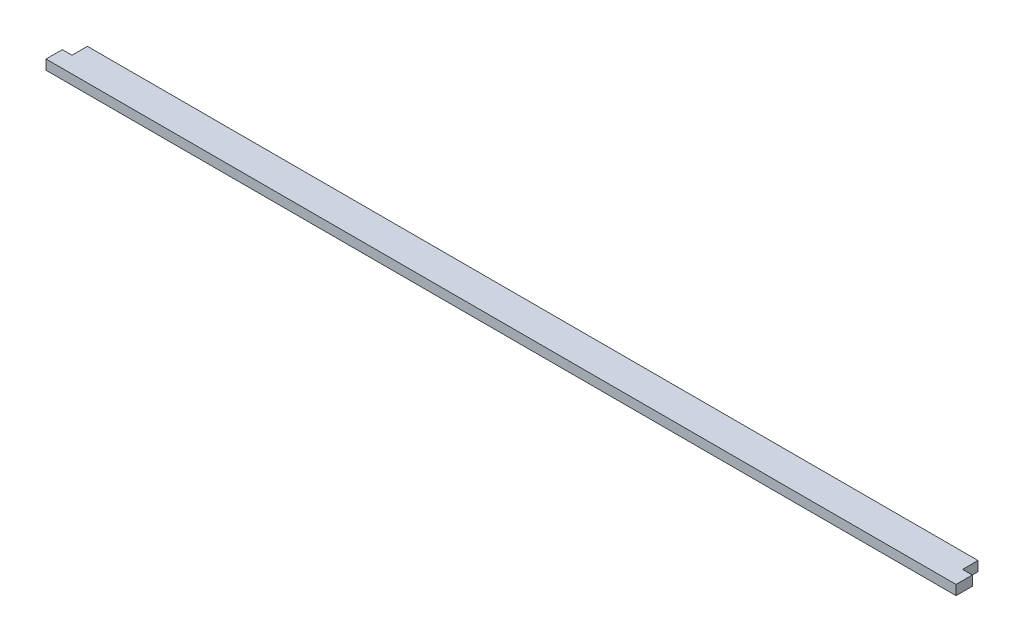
SolidWorks part; units mm, degrees
ref_plane "Alzado" through (0, 0, 0) normal (0, 0, 1) x (1, 0, 0)
ref_plane "Planta" through (0, 0, 0) normal (0, 1, 0) x (1, 0, 0)
ref_plane "Vista lateral" through (0, 0, 0) normal (1, 0, 0) x (0, 0, -1)
sketch "Croquis1" plane through (0, 0, 0) normal (0, 1, 0) x (1, 0, 0)
  line L0 (-560, 10) -> (-560, 30)
  line L3 (-548, 50) -> (548, 50)
  line L5 (-548, -50) -> (548, 50) construction
  line L6 (-548, 50) -> (548, -50) construction
  line L11 (-548, 30) -> (-560, 30)
  line L13 (-548, 10) -> (-560, 10)
  line L18 (0, 50) -> (0, 142.0008) construction
  line L31 (-548, 30) -> (-548, 50)
  line L34 (548, 30) -> (548, 50)
  line L40 (548, 10) -> (560, 10)
  line L41 (548, 30) -> (560, 30)
  line L45 (560, 10) -> (560, 30)
  line L46 (-548, 10) -> (548, 10)
  point P0 (0, 0)
extrude "Saliente-Extruir1" add sketch "Croquis1" along normal blind 12
sketch "Croquis2" plane through (0, 0, 0) normal (0, 1, 0) x (1, 0, 0)
  line L0 (548, 30) -> (548, 50) construction
  line L1 (-548, 50) -> (548, 50)
  line L2 (-548, 50) -> (-548, 49)
  line L3 (-548, 49) -> (548, 49)
  line L4 (548, 50) -> (548, 49)
  dimension "D1" = 1
extrude "Cortar-Extruir2" cut sketch "Croquis2" along normal through all
equation "\"ancho\"= \"ancho_joint\" * 5"
equation "\"alto\"= \"largo\" - \"material\" * 2"
equation "\"material\"= 1.2"
equation "\"ancho_joint_sep\"=3.75"
equation "\"ancho_joint\"= 2"
equation "\"D8@Croquis1\"=\"ancho_joint\""
equation "\"D1@Saliente-Extruir1\"=\"material\""
equation "\"largo\"= 112"
equation "\"D2@Croquis1\"=\"ancho_joint\""
equation "\"D1@Croquis1\"=\"alto\""
